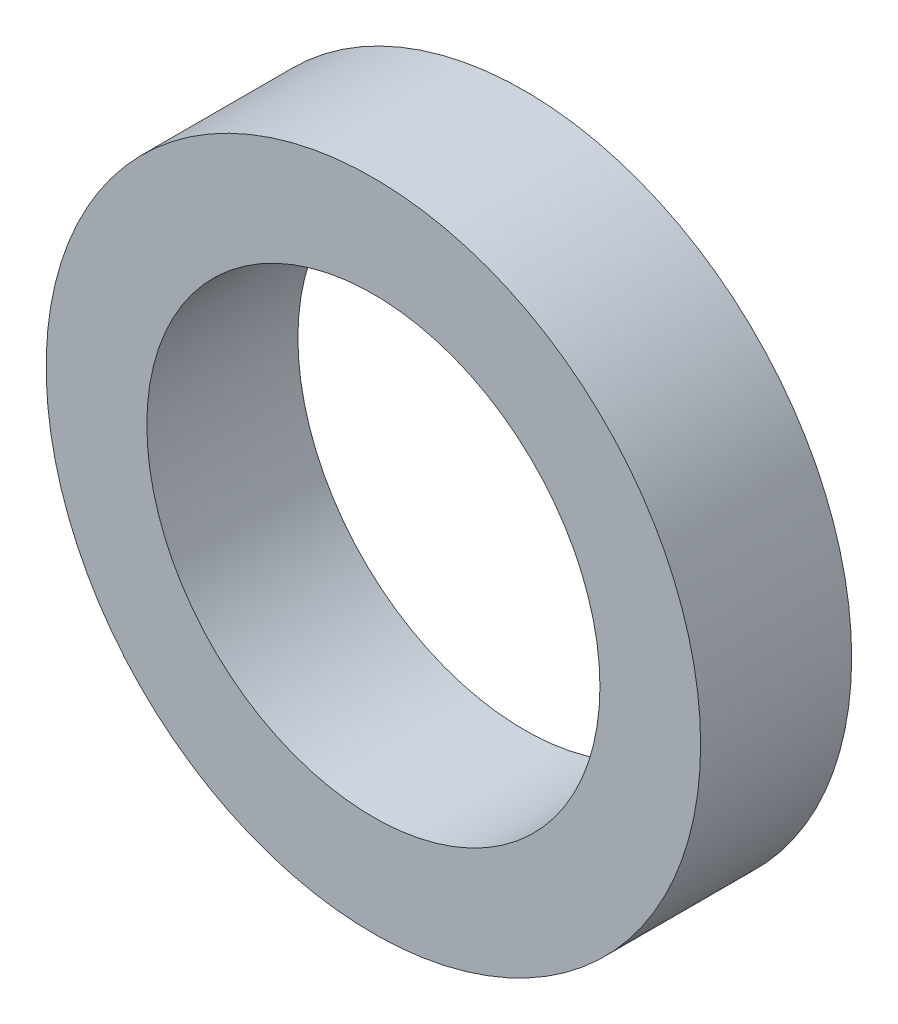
SolidWorks part; units mm, degrees
ref_plane "前视基准面" through (0, 0, 0) normal (0, 0, 1) x (1, 0, 0)
ref_plane "上视基准面" through (0, 0, 0) normal (0, 1, 0) x (1, 0, 0)
ref_plane "右视基准面" through (0, 0, 0) normal (1, 0, 0) x (0, 0, -1)
sketch "草图1" plane through (0, 0, 0) normal (0, 1, 0) x (1, 0, 0)
  line L0 (0, 0) -> (0, 18.708) construction
  line L2 (-4.5, 0) -> (-6.5, 0)
  line L3 (-4.5, 0) -> (-4.5, 3)
  line L4 (-4.5, 3) -> (-6.5, 3)
  line L5 (-6.5, 0) -> (-6.5, 3)
  dimension "D1" = 4.5
  dimension "D2" = 2
  dimension "D3" = 3
revolve "旋转1" add sketch "草图1" angle 360 about L0
